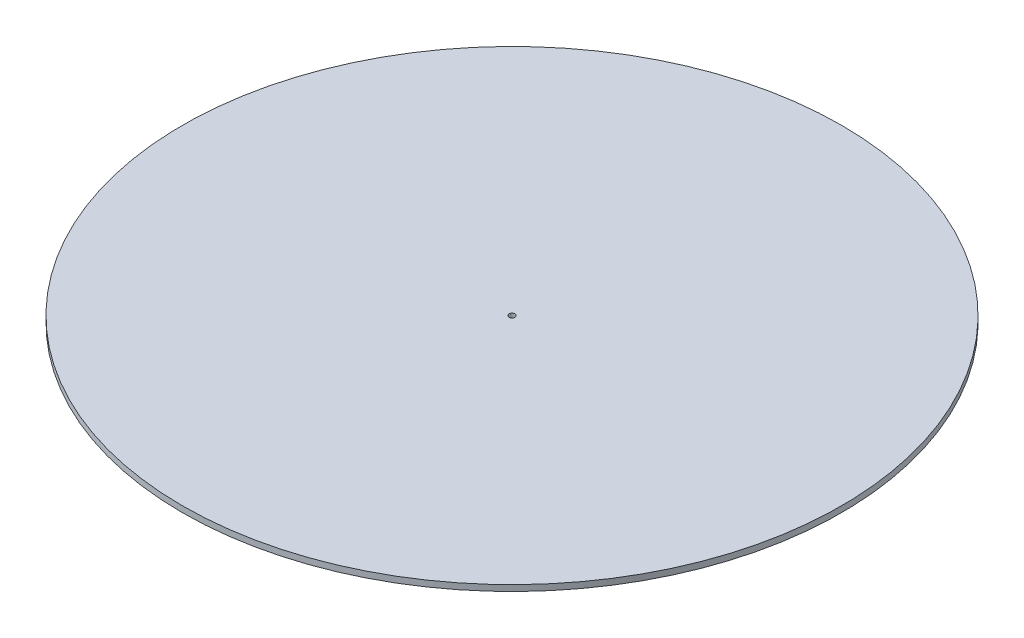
SolidWorks part; units mm, degrees
ref_plane "前视基准面" through (0, 0, 0) normal (0, 0, 1) x (1, 0, 0)
ref_plane "上视基准面" through (0, 0, 0) normal (0, 1, 0) x (1, 0, 0)
ref_plane "右视基准面" through (0, 0, 0) normal (1, 0, 0) x (0, 0, -1)
sketch "草图1" plane through (0, 0, 0) normal (0, 1, 0) x (1, 0, 0)
  circle A0 centre (0, 0) radius 550
  circle A1 centre (0, 0) radius 5
  dimension "D1" = 1100
  dimension "D2" = 10
extrude "凸台-拉伸1" add sketch "草图1" along normal blind 10
